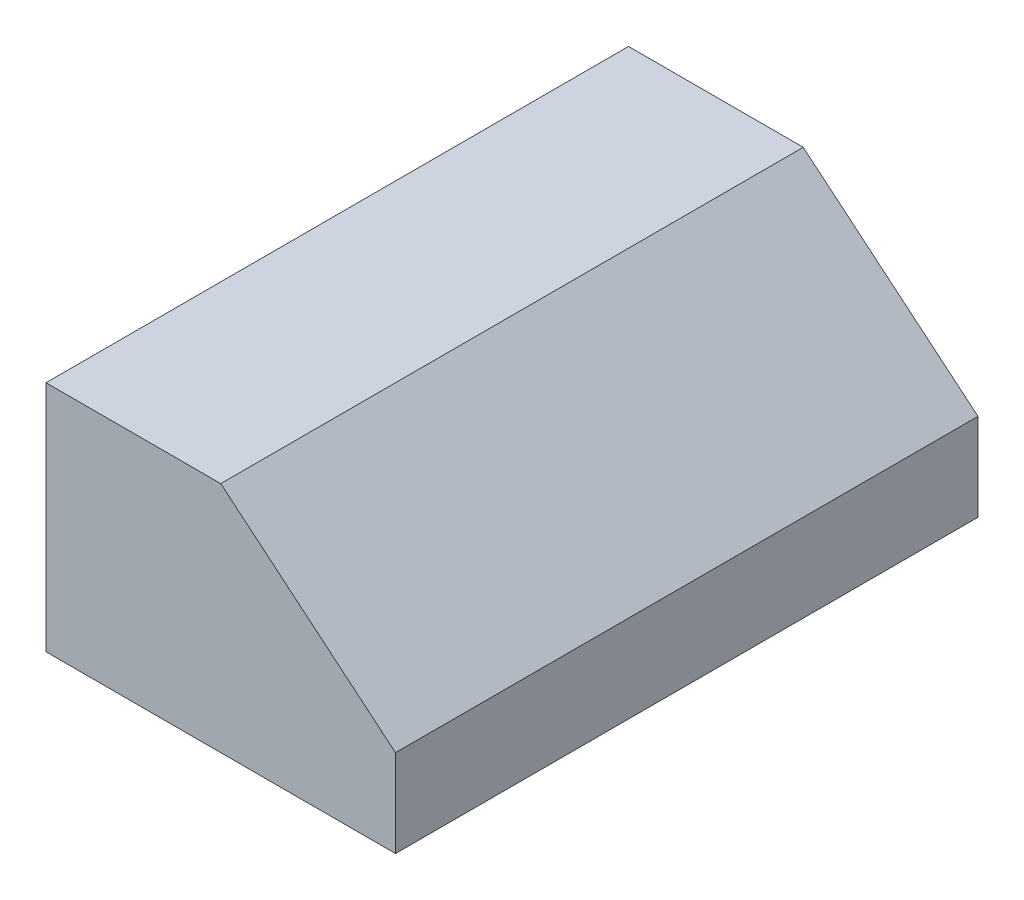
SolidWorks part; units mm, degrees
ref_plane "Front Plane" through (0, 0, 0) normal (0, 0, 1) x (1, 0, 0)
ref_plane "Top Plane" through (0, 0, 0) normal (0, 1, 0) x (1, 0, 0)
ref_plane "Right Plane" through (0, 0, 0) normal (1, 0, 0) x (0, 0, -1)
sketch "Sketch1" plane through (0, 0, 0) normal (0, 0, 1) x (1, 0, 0)
  line L1 (0, 0) -> (76.2, 0)
  line L2 (0, 0) -> (0, 50.8)
  line L3 (0, 50.8) -> (76.2, 50.8)
  line L4 (76.2, 0) -> (76.2, 50.8)
  dimension "D1" = 50.8
  dimension "D2" = 76.2
extrude "Extrude1" add sketch "Sketch1" along normal blind 127
sketch "Sketch2" plane through (0, 0, 127) normal (0, 0, 1) x (1, 0, 0)
  line L0 (38.1, 50.8) -> (76.2, 50.8)
  line L1 (76.2, 50.8) -> (0, 50.8) construction
  line L2 (76.2, 50.8) -> (76.2, 19.05)
  line L3 (76.2, 0) -> (76.2, 50.8) construction
  line L4 (76.2, 19.05) -> (38.1, 50.8)
  line L5 (0, 50.8) -> (0, 0) construction
  line L6 (0, 0) -> (76.2, 0) construction
  dimension "D1" = 38.1
  dimension "D2" = 19.05
extrude "Cut-Extrude1" cut sketch "Sketch2" against normal blind 127
